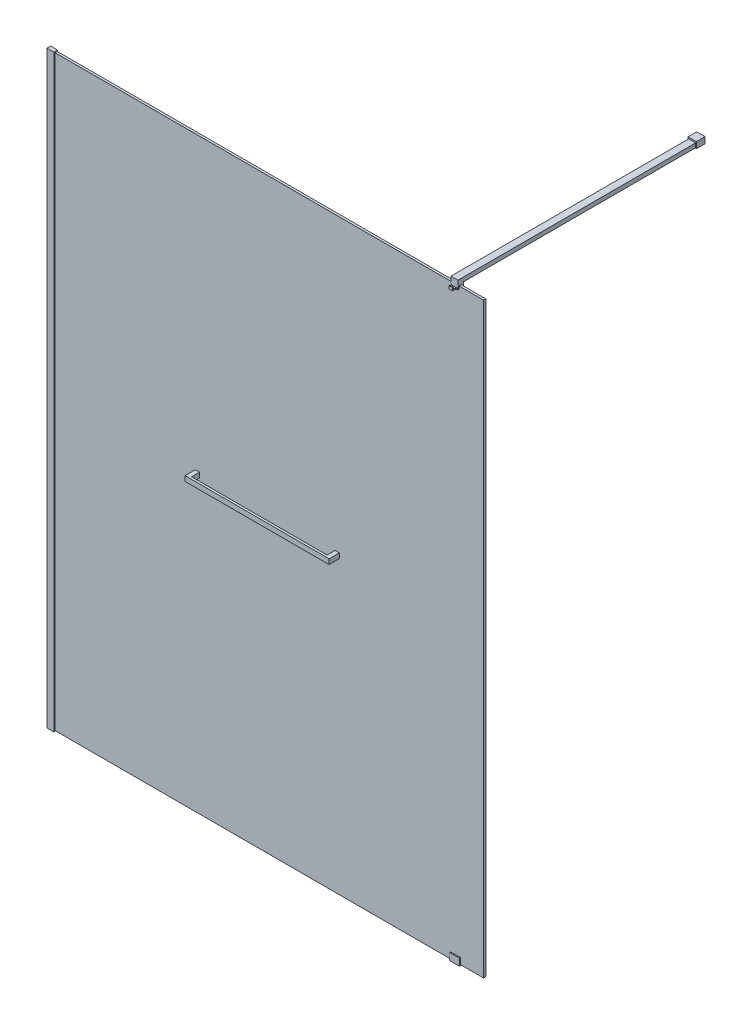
SolidWorks part; units mm, degrees
ref_plane "Płaszczyzna przednia" through (0, 0, 0) normal (0, 0, 1) x (1, 0, 0)
ref_plane "Płaszczyzna górna" through (0, 0, 0) normal (0, 1, 0) x (1, 0, 0)
ref_plane "Płaszczyzna prawa" through (0, 0, 0) normal (1, 0, 0) x (0, 0, -1)
sketch "Szkic1" plane through (0, 0, 0) normal (0, 1, 0) x (1, 0, 0)
  line L0 (0, 0) -> (0, 13.3)
  line L2 (0, 13.3) -> (25, 13.3)
  line L3 (25, 13.3) -> (25, 11.4)
  line L4 (25, 11.4) -> (11.45, 11.4)
  line L5 (11.45, 11.4) -> (11.45, 3.4)
  line L6 (11.45, 3.4) -> (25, 3.4)
  line L7 (25, 3.4) -> (25, 0)
  line L8 (25, 0) -> (0, 0)
  dimension "D1" = 13.3
  dimension "D4" = 1.9
  dimension "D5" = 8
  dimension "D6" = 3.4
  dimension "D7" = 13.55
  dimension "D8" = 25
extrude "Dodanie-wyciągnięcie1" add sketch "Szkic1" along normal blind 2100
sketch "Szkic2" plane through (0, 0, 0) normal (0, -1, 0) x (1, 0, 0)
  line L0 (11.45, -3.4) -> (1558.45, -3.4)
  line L1 (11.45, -3.4) -> (11.45, -11.4)
  line L2 (1558.45, -3.4) -> (1558.45, -11.4)
  line L3 (11.45, -11.4) -> (1558.45, -11.4)
  line L4 (11.45, -11.4) -> (25, -11.4) construction
  dimension "D1" = 1547
extrude "Dodanie-wyciągnięcie2" add sketch "Szkic2" against normal blind 2100 separate body
sketch "Szkic4" plane through (0, 2100, 0) normal (0, 1, 0) x (1, 0, 0)
  line L1 (25, 13.3) -> (0, 13.3) construction
  line L2 (25, 11.4) -> (25, 13.3) construction
  line L3 (0, 13.3) -> (0, 0) construction
  line L5 (0, 0) -> (25, 0) construction
  line L7 (25, 13.3) -> (0, 13.3)
  line L8 (25, 0) -> (25, 13.3)
  line L9 (0, 13.3) -> (0, 0)
  line L11 (0, 0) -> (25, 0)
extrude "Dodanie-wyciągnięcie3" add sketch "Szkic4" along normal blind 3
sketch "Szkic5" plane through (0, 0, 0) normal (0, -1, 0) x (1, 0, 0)
  line L1 (0, 0) -> (25, 0) construction
  line L2 (25, 0) -> (25, -3.4) construction
  line L3 (0, -13.3) -> (0, 0) construction
  line L5 (25, -13.3) -> (0, -13.3) construction
  line L7 (0, 0) -> (25, 0)
  line L8 (25, 0) -> (25, -13.3)
  line L9 (0, -13.3) -> (0, 0)
  line L11 (25, -13.3) -> (0, -13.3)
extrude "Dodanie-wyciągnięcie4" add sketch "Szkic5" along normal blind 3
ref_plane "Płaszczyzna1" through (1458.45, 0, 0) normal (1, 0, 0) x (0, 0, -1)
sketch "Szkic6" plane through (1458.45, 0, 0) normal (1, 0, 0) x (0, 0, -1)
  line L0 (11.4, 22) -> (15.75, 22)
  line L1 (15.75, 22) -> (15.75, -3)
  line L2 (15.75, -3) -> (-0.35, -3)
  line L3 (-0.35, -3) -> (-0.35, 22)
  line L4 (-0.35, 22) -> (3.4, 22)
  line L5 (11.4, 22) -> (11.4, 0)
  line L6 (11.4, 0) -> (11.4, 2100)
  line L7 (11.4, 0) -> (11.4, 2100) construction
  line L8 (3.4, 2100) -> (3.4, 0)
  line L9 (3.4, 2100) -> (3.4, 0) construction
  line L10 (11.4, 0) -> (3.4, 0)
  line L11 (3.4, 0) -> (3.4, 22)
  dimension "D1" = 4.35
  dimension "D2" = 25
  dimension "D3" = 3
  dimension "D4" = 3.75
extrude "Dodanie-wyciągnięcie5" add sketch "Szkic6" along normal mid plane 35 separate body
sketch "Szkic7" plane through (1458.45, 0, 0) normal (1, 0, 0) x (0, 0, -1)
  line L0 (3.4, 2100) -> (3.4, 0) construction
  line L1 (-0.6, 2120) -> (19.4, 2120)
  line L2 (3.4, 2100) -> (3.4, 0) construction
  line L4 (11.4, 2100) -> (3.4, 2100) construction
  line L13 (11.4, 2100) -> (11.4, 0) construction
  line L20 (19.4, 2120) -> (19.4, 2090)
  line L25 (19.4, 2090) -> (11.4, 2090)
  line L26 (11.4, 2090) -> (11.4, 2100)
  line L27 (11.4, 2100) -> (3.4, 2100)
  line L28 (3.4, 2100) -> (3.4, 2090)
  line L29 (3.4, 2090) -> (-13.37, 2090)
  line L30 (-13.37, 2090) -> (-13.37, 2100)
  line L31 (-13.37, 2100) -> (-10.37, 2100)
  line L32 (-10.37, 2100) -> (-9.8451, 2094)
  line L33 (-9.8451, 2094) -> (-0.6, 2094)
  line L34 (-0.6, 2094) -> (-0.6, 2120)
  dimension "D3" = 20
  dimension "D4" = 30
  dimension "D5" = 16.77
  dimension "D6" = 4
  dimension "D14" = 8
  dimension "D21" = 10
  dimension "D22" = 4
  dimension "D23" = 3
  dimension "D24" = 95
extrude "Dodanie-wyciągnięcie6" add sketch "Szkic7" along normal mid plane 25 separate body
sketch "Szkic8" plane through (0, 2100, 0) normal (0, 1, 0) x (1, 0, 0)
  line L0 (1445.95, -0.6) -> (1452.45, -3.631)
  line L1 (1452.45, -3.631) -> (1452.45, -13.37)
  line L2 (1470.95, -0.6) -> (1464.45, -3.631)
  line L3 (1464.45, -3.631) -> (1464.45, -13.37)
  line L4 (1458.45, -10.37) -> (1458.45, 156.6902) construction
  line L5 (1470.95, -10.37) -> (1445.95, -10.37) construction
  line L6 (1452.45, -13.37) -> (1464.45, -13.37)
  line L7 (1470.95, -13.37) -> (1445.95, -13.37) construction
  dimension "D1" = 12
  dimension "D2" = 115
extrude "Wytnij-wyciągnięcie1" cut sketch "Szkic8" against normal through all and the other way through all
sketch "Szkic10" plane through (0, 2120, 0) normal (0, 1, 0) x (1, 0, 0)
  line L0 (1458.45, 31.9) -> (1458.45, 19.4) construction
  line L1 (1445.95, 881.03) -> (1470.95, 881.03)
  line L2 (1445.95, 881.03) -> (1445.95, 19.4)
  line L3 (1445.95, 19.4) -> (1470.95, 19.4)
  line L4 (1470.95, 19.4) -> (1445.95, 19.4) construction
  line L5 (1445.95, 19.4) -> (1445.95, -0.6) construction
  line L6 (1470.95, 881.03) -> (1470.95, 19.4)
  point P4 (1458.45, 31.9)
  dimension "D2" = 861.63
  dimension "D1" = 25
  dimension "D3" = 12.5
extrude "Dodanie-wyciągnięcie7" add sketch "Szkic10" against normal blind 15
sketch "Szkic14" plane through (0, 0, -881.03) normal (0, 0, -1) x (-1, 0, 0)
  line L1 (-1473.45, 2125) -> (-1443.45, 2125)
  line L2 (-1473.45, 2125) -> (-1473.45, 2103)
  line L3 (-1473.45, 2103) -> (-1443.45, 2103)
  line L4 (-1443.45, 2125) -> (-1443.45, 2103)
  line L5 (-1473.45, 2125) -> (-1443.45, 2103) construction
  line L6 (-1473.45, 2103) -> (-1443.45, 2125) construction
  line L7 (-1458.45, 2120) -> (-1458.45, 2114) construction
  line L8 (-1470.95, 2120) -> (-1445.95, 2120) construction
  line L9 (-1470.95, 2105) -> (-1445.95, 2105) construction
  point P0 (-1458.45, 2114)
  dimension "D1" = 30
  dimension "D2" = 22
  dimension "D3" = 2
extrude "Dodanie-wyciągnięcie8" add sketch "Szkic14" against normal blind 31
sketch "Szkic17" plane through (0, 0, -3.4) normal (0, 0, 1) x (1, 0, 0)
  line L0 (784.95, 2100) -> (784.95, 1050) construction
  line L1 (1558.45, 2100) -> (11.45, 2100) construction
  line L2 (784.95, 1050) -> (784.95, 0) construction
  line L3 (1558.45, 0) -> (11.45, 0) construction
  line L4 (534.95, 1050) -> (1034.95, 1050) construction
  line L6 (527.45, 1059) -> (542.45, 1059)
  line L7 (527.45, 1059) -> (527.45, 1041)
  line L8 (527.45, 1041) -> (542.45, 1041)
  line L9 (542.45, 1059) -> (542.45, 1041)
  line L10 (527.45, 1059) -> (542.45, 1041) construction
  line L11 (527.45, 1041) -> (542.45, 1059) construction
  line L12 (1027.45, 1059) -> (1042.45, 1059)
  line L13 (1027.45, 1059) -> (1027.45, 1041)
  line L14 (1027.45, 1041) -> (1042.45, 1041)
  line L15 (1042.45, 1059) -> (1042.45, 1041)
  line L16 (1027.45, 1059) -> (1042.45, 1041) construction
  line L17 (1027.45, 1041) -> (1042.45, 1059) construction
  dimension "D1" = 500
  dimension "D2" = 15
  dimension "D3" = 18
extrude "polka_1a" add sketch "Szkic17" along normal blind 36.5 and the other way blind 31 separate body
sketch "Szkic18" plane through (527.45, 0, 0) normal (-1, 0, 0) x (0, 0, 1)
  line L0 (-34.4, 1059) -> (-34.4, 1041) construction
  line L1 (-34.4, 1053.73) -> (-21.6, 1053.73)
  line L2 (-34.4, 1053.73) -> (-34.4, 1045.73)
  line L3 (-34.4, 1045.73) -> (-21.6, 1045.73)
  line L4 (-21.6, 1053.73) -> (-21.6, 1045.73)
  line L5 (-34.4, 1041) -> (33.1, 1041) construction
  dimension "D1" = 4.73
  dimension "D2" = 8
  dimension "D3" = 12.8
extrude "polka_1b" cut sketch "Szkic18" against normal up to surface (515 mm away)
sketch "Szkic19" plane through (0, 1059, 0) normal (0, 1, 0) x (1, 0, 0)
  line L0 (1042.45, 21.6) -> (527.45, 21.6)
  line L1 (1042.45, 21.6) -> (1042.45, 101.6)
  line L2 (527.45, 21.6) -> (527.45, 101.6)
  line L3 (1042.45, 101.6) -> (527.45, 101.6)
  line L4 (1042.45, 34.4) -> (1042.45, -33.1) construction
  line L5 (527.45, 34.4) -> (527.45, -33.1) construction
  line L6 (11.45, 11.4) -> (1558.45, 11.4) construction
  dimension "D1" = 10.2
  dimension "D2" = 80
extrude "polka_1c" add sketch "Szkic19" against normal blind 8 from offset 5.28 separate body
sketch "Szkic20" plane through (542.45, 0, 0) normal (1, 0, 0) x (0, 0, -1)
  line L0 (34.4, 1041) -> (-33.1, 1041) construction
  line L1 (-33.1, 1059) -> (-25.1, 1059)
  line L2 (-33.1, 1059) -> (-33.1, 1041)
  line L3 (-33.1, 1041) -> (-25.1, 1041)
  line L4 (-25.1, 1059) -> (-25.1, 1041)
  dimension "D1" = 8
extrude "polka_1d" add sketch "Szkic20" along normal up to surface (485 mm away)
